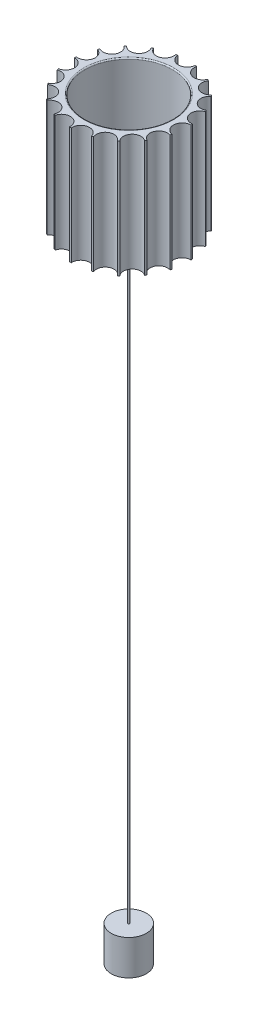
SolidWorks part; units mm, degrees
ref_plane "Alzado" through (0, 0, 0) normal (0, 0, 1) x (1, 0, 0)
ref_plane "Planta" through (0, 0, 0) normal (0, 1, 0) x (1, 0, 0)
ref_plane "Vista lateral" through (0, 0, 0) normal (1, 0, 0) x (0, 0, -1)
sketch "Croquis1" plane through (0, 0, 0) normal (0, 1, 0) x (1, 0, 0)
  circle A0 centre (0, 0) radius 100
  dimension "D1" = 200
extrude "Saliente-Extruir1" add sketch "Croquis1" along normal blind 200
sketch "Croquis2" plane through (0, 200, 0) normal (0, 1, 0) x (1, 0, 0)
  line L0 (0, 0) -> (0, 100) construction
  circle A0 centre (0, 0) radius 100 construction
  circle A1 centre (0, 100) radius 15
  circle A2 centre (32.4699, 94.5817) radius 15
  circle A3 centre (61.4213, 78.9141) radius 15
  circle A4 centre (83.7166, 54.6948) radius 15
  circle A5 centre (96.94, 24.5485) radius 15
  circle A6 centre (99.6584, -8.2579) radius 15
  circle A7 centre (91.5773, -40.1695) radius 15
  circle A8 centre (73.5724, -67.7282) radius 15
  circle A9 centre (47.5947, -87.9474) radius 15
  circle A10 centre (16.4595, -98.6361) radius 15
  circle A11 centre (-16.4595, -98.6361) radius 15
  circle A12 centre (-47.5947, -87.9474) radius 15
  circle A13 centre (-73.5724, -67.7282) radius 15
  circle A14 centre (-91.5773, -40.1695) radius 15
  circle A15 centre (-99.6584, -8.2579) radius 15
  circle A16 centre (-96.94, 24.5485) radius 15
  circle A17 centre (-83.7166, 54.6948) radius 15
  circle A18 centre (-61.4213, 78.9141) radius 15
  circle A19 centre (-32.4699, 94.5817) radius 15
  point P8 (-17.9574, 98.3745)
  point P9 (-14.9578, 98.875)
  point P45 (0, 0)
  dimension "D1" = 30
  dimension "D2" = 19
extrude "Cortar-Extruir1" cut sketch "Croquis2" against normal blind 200
sketch "Croquis5" plane through (0, 200, 0) normal (0, 1, 0) x (1, 0, 0)
  circle A0 centre (0, 0) radius 75
  dimension "D1" = 150
extrude "Cortar-Extruir2" cut sketch "Croquis5" against normal blind 180
sketch "Croquis6" plane through (0, 20, 0) normal (0, 1, 0) x (1, 0, 0)
  circle A0 centre (0, 0) radius 5
  dimension "D1" = 10
extrude "Cortar-Extruir3" cut sketch "Croquis6" against normal blind 180
fillet "Redondeo1" radius 2 1 edges at (0, 200, 75)
sketch "Croquis7" plane through (0, 0, 0) normal (0, -1, 0) x (1, 0, 0)
  circle A0 centre (0, 0) radius 5
  dimension "D1" = 10
extrude "Saliente-Extruir4" add sketch "Croquis7" along normal blind 30 separate body
sketch "Croquis8" plane through (0, -30, 0) normal (0, -1, 0) x (1, 0, 0)
  circle A0 centre (0, 0) radius 1.5
  dimension "D1" = 3
extrude "Saliente-Extruir5" add sketch "Croquis8" along normal blind 1000 separate body
sketch "Croquis9" plane through (0, -1030, 0) normal (0, -1, 0) x (1, 0, 0)
  circle A0 centre (0, 0) radius 30
  dimension "D1" = 60
extrude "Saliente-Extruir6" add sketch "Croquis9" along normal blind 60 separate body
sketch "Croquis3" plane through (0, 0, 0) normal (0, -1, 0) x (1, 0, 0)
  circle A0 centre (0, 0) radius 110
  dimension "D1" = 220
extrude "Saliente-Extruir2" add sketch "Croquis3" along normal blind 3 separate body
sketch "Croquis4" plane through (0, 200, 0) normal (0, 1, 0) x (1, 0, 0)
  circle A0 centre (0, 0) radius 100
  dimension "D1" = 200
extrude "Saliente-Extruir3" add sketch "Croquis4" along normal blind 3 separate body
